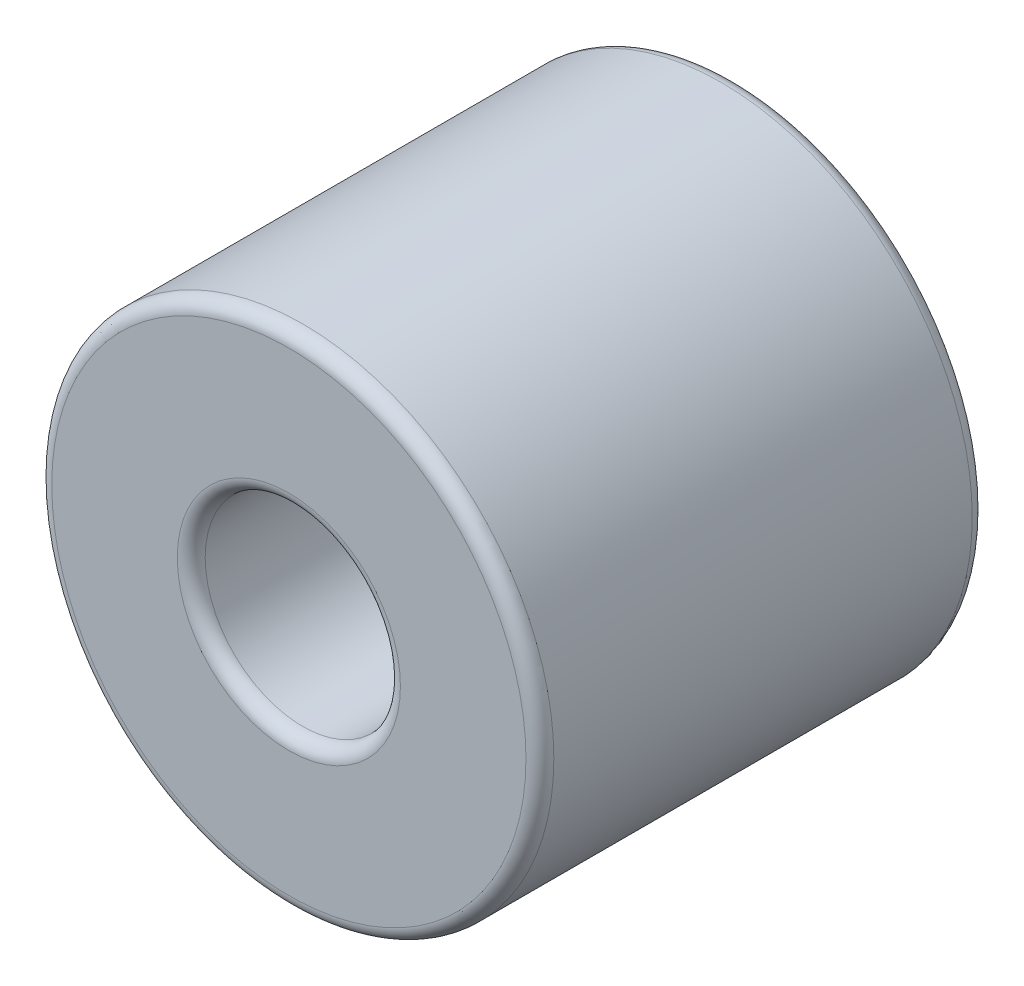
SolidWorks part; units mm, degrees
ref_plane "Спереди" through (0, 0, 0) normal (0, 0, 1) x (1, 0, 0)
ref_plane "Сверху" through (0, 0, 0) normal (0, 1, 0) x (1, 0, 0)
ref_plane "Справа" through (0, 0, 0) normal (1, 0, 0) x (0, 0, -1)
sketch "Эскиз1" plane through (0, 0, 0) normal (1, 0, 0) x (0, 0, -1)
  line L0 (-4, 0) -> (4, 0) construction
  line L1 (-4, 1.75) -> (4, 1.75)
  line L2 (4, 1.75) -> (4, 4.5)
  line L3 (4, 4.5) -> (-4, 4.5)
  line L4 (-4, 4.5) -> (-4, 1.75)
  dimension "D1" = 8
  dimension "D2" = 3.5
  dimension "D3" = 9
revolve "Повернуть1" add sketch "Эскиз1" angle 360 about L0
fillet "Скругление1" radius 0.25 4 edges at (1.75, 0, 4) (1.75, 0, -4) (4.5, 0, -4) (4.5, 0, 4)
